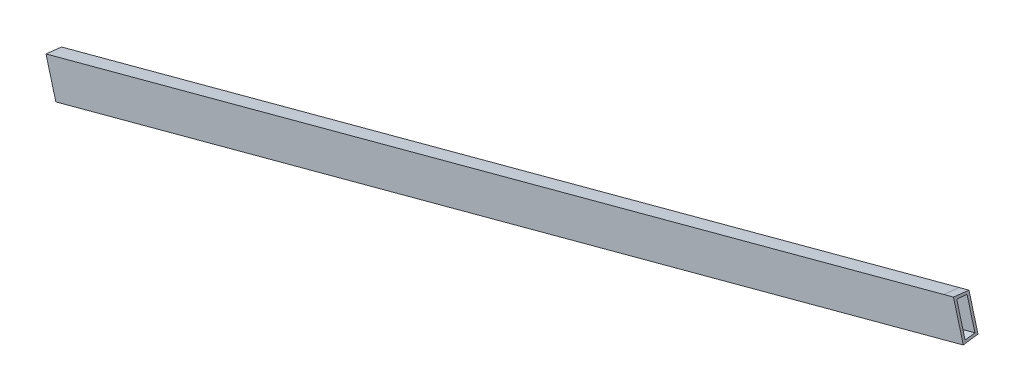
SolidWorks part; units mm, degrees
ref_plane "Front Plane" through (0, 0, 0) normal (0, 0, 1) x (1, 0, 0)
ref_plane "Top Plane" through (0, 0, 0) normal (0, 1, 0) x (1, 0, 0)
ref_plane "Right Plane" through (0, 0, 0) normal (1, 0, 0) x (0, 0, -1)
curve "Curve1"
sketch "Sketch1" plane through (0, 0, 0) normal (1, 0, 0) x (0, 0, -1)
  line L0 (64.2938, 17.9381) -> (64.2938, 7.3735)
  line L1 (0, 0) -> (0, 95.7684) construction
  line L4 (67.4688, 17.6298) -> (67.4688, 7.7502)
  line L5 (65.0938, 17.0589) -> (65.0938, 8.2772)
  line L6 (66.6687, 16.9056) -> (66.6687, 8.4636)
  spline S0 degree 1 poles (65.0938, 8.2772) (66.6687, 8.4636) knots 0 0 1 1 construction
  spline S1 degree 1 poles (66.6687, 16.9056) (65.0938, 17.0589) knots 0 0 1 1 construction
  spline S2 degree 3 poles (65.0938, 8.2772) (65.6186, 8.3406) (66.1436, 8.4027) (66.6687, 8.4636) knots 0.731305 0.731305 0.731305 0.731305 0.736464 0.736464 0.736464 0.736464
  spline S3 degree 3 poles (66.6687, 16.9056) (66.1438, 16.9577) (65.6189, 17.0088) (65.0938, 17.0589) knots 1.268574 1.268574 1.268574 1.268574 1.273764 1.273764 1.273764 1.273764
  spline S5 degree 3 poles (64.2938, 7.3735) (65.3515, 7.504) (66.4098, 7.6297) (67.4688, 7.7502) knots 0.728362 0.728362 0.728362 0.728362 0.738787 0.738787 0.738787 0.738787
  spline S6 degree 3 poles (67.4688, 17.6298) (66.4108, 17.7363) (65.3525, 17.8393) (64.2938, 17.9381) knots 1.266201 1.266201 1.266201 1.266201 1.276646 1.276646 1.276646 1.276646
  dimension "D1" = 0.8001
extrude "Boss-Extrude1" add sketch "Sketch1" along normal blind 25.4
ref_plane "Plane1" through (310.6141, 0, 0) normal (1, 0, 0) x (0, 0, -1)
sketch "Sketch2" plane through (0, 0, -64.2937) normal (0, 0, 1) x (1, 0, 0)
  line L0 (25.4, 7.3735) -> (310.6141, 7.3735) construction
  line L1 (310.6141, -55) -> (310.6141, 55) construction
  line L2 (25.4, 7.3735) -> (310.6141, 83.7963)
  dimension "D1" = 15
sketch "Sketch3" plane through (25.4, 0, 0) normal (1, 0, 0) x (0, 0, -1)
  line L1 (63.5, 18.8093) -> (63.5, 6.4757)
  line L2 (68.2625, 7.0416) -> (68.2625, 18.3477)
  line L6 (64.2938, 17.9381) -> (64.2938, 7.3735)
  line L7 (67.4688, 7.7502) -> (67.4688, 17.6298)
  line L8 (64.2938, 17.9381) -> (64.2938, 7.3735)
  line L9 (67.4688, 7.7502) -> (67.4688, 17.6298)
  spline S0 degree 1 poles (63.5, 6.4757) (68.2625, 7.0416) knots 0 0 1 1 construction
  spline S1 degree 1 poles (68.2625, 18.3477) (63.5, 18.8093) knots 0 0 1 1 construction
  spline S2 degree 3 poles (119.6461, 2956.7409) (-900.6484, -3170.3465) (726.6922, 3146.0713) (392.6353, -2925.1901) knots -1.938074 -1.938074 -1.938074 -1.938074 2.956328 2.956328 2.956328 2.956328 only from (64.2938, 7.3735) to (67.4688, 7.7502)
  spline S3 degree 3 poles (686.639, 2925.5717) (127.9611, -2970.4064) (45.8681, 3002.9346) (-554.569, -2894.7055) knots -0.417714 -0.417714 -0.417714 -0.417714 2.85636 2.85636 2.85636 2.85636 only from (67.4688, 17.6298) to (64.2938, 17.9381)
  spline S4 degree 3 poles (64.2938, 7.3735) (65.3515, 7.504) (66.4098, 7.6297) (67.4688, 7.7502) knots 0.728362 0.728362 0.728362 0.728362 0.738787 0.738787 0.738787 0.738787
  spline S5 degree 3 poles (67.4688, 17.6298) (66.4108, 17.7363) (65.3525, 17.8393) (64.2938, 17.9381) knots 1.266201 1.266201 1.266201 1.266201 1.276646 1.276646 1.276646 1.276646
  spline S6 degree 3 poles (63.5, 6.4757) (65.0866, 6.6716) (66.6741, 6.8609) (68.2625, 7.0416) knots 0.725435 0.725435 0.725435 0.725435 0.741098 0.741098 0.741098 0.741098
  spline S7 degree 3 poles (68.2625, 18.3477) (66.6756, 18.5074) (65.088, 18.6612) (63.5, 18.8093) knots 1.26385 1.26385 1.26385 1.26385 1.279499 1.279499 1.279499 1.279499
  dimension "D1" = 0.7937
  dimension "D2" = 0
sweep "Sweep1" add profiles "Sketch3" path "Sketch2"
sketch "Sketch4" plane through (25.4, 0, 0) normal (-1, 0, 0) x (0, 0, 1)
  line L1 (-79.8649, 22.2221) -> (-55.8678, 22.2221)
  line L2 (-79.8649, 22.2221) -> (-79.8649, 1.8354)
  line L3 (-79.8649, 1.8354) -> (-55.8678, 1.8354)
  line L4 (-55.8678, 22.2221) -> (-55.8678, 1.8354)
extrude "Cut-Extrude1" cut sketch "Sketch4" along normal through all
sketch "Sketch5" plane through (0, 0, -63.5) normal (0, 0, 1) x (1, 0, 0)
  line L0 (25.4, 18.8093) -> (28.4834, 7.3019)
  line L1 (25.4, 6.4757) -> (310.6141, 82.8986) construction
  line L2 (28.4834, 7.3019) -> (25.4, 6.4757)
  line L3 (25.4, 6.4757) -> (25.4, 18.8093)
  line L4 (310.6141, 95.2322) -> (310.6141, 82.8986)
  line L5 (310.6141, 82.8986) -> (307.5307, 94.406)
  line L6 (25.4, 18.8093) -> (310.6141, 95.2322) construction
  line L7 (307.5307, 94.406) -> (310.6141, 95.2322)
  dimension "D1" = 15
  dimension "D2" = 15
extrude "Cut-Extrude2" cut sketch "Sketch5" against normal through all both and the other way through all
sketch "Sketch7" plane through (310.5315, 83.2067, 0) normal (0.9659, 0.2588, 0) x (0, 0, -1)
  line L0 (63.5, 11.5944) -> (63.5, -0.319) construction
  line L1 (63.5, 11.5944) -> (63.5, -0.319)
  line L2 (68.2625, 11.1485) -> (68.2625, 0.2277) construction
  line L3 (68.2625, 11.1485) -> (68.2625, 0.2277)
  line L4 (64.2938, 0.5482) -> (64.2938, 10.7528) construction
  line L5 (64.2938, 0.5482) -> (64.2938, 10.7528)
  line L6 (67.4688, 10.4551) -> (67.4688, 0.9121) construction
  line L7 (67.4688, 10.4551) -> (67.4688, 0.9121)
  spline S0 degree 3 poles (275.4327, -2902.4905) (648.0072, -248.6355) (367.1582, -17.3637) (67.0718, 11.2632) (66.6748, 11.301) (66.2779, 11.3385) (65.8809, 11.3757) (-286.7965, 44.3886) (-665.5105, -198.2892) (-106.4403, 2886.5282) knots -0.90315 -0.90315 -0.90315 -0.90315 0.001196 0.001196 0.001196 0.002392 0.002392 0.002392 1.065051 1.065051 1.065051 1.065051 only from (68.2625, 11.1485) to (63.5, 11.5944) construction
  spline S1 degree 3 poles (68.2625, 11.1485) (67.8656, 11.1871) (67.4687, 11.2253) (67.0718, 11.2632) (66.6748, 11.301) (66.2779, 11.3385) (65.8809, 11.3757) (65.0874, 11.45) (64.2937, 11.5229) (63.5, 11.5944) knots 0 0 0 0 0.001196 0.001196 0.001196 0.002392 0.002392 0.002392 0.004783 0.004783 0.004783 0.004783
  spline S2 degree 3 poles (-707.7686, 2865.0271) (-298.5546, -138.8599) (-122.4642, -22.1015) (64.6907, -0.1782) (65.0877, -0.1317) (65.4847, -0.0856) (65.8818, -0.04) (241.9162, 20.1834) (428.4083, -49.456) (768.0191, -2889.3724) knots -0.564105 -0.564105 -0.564105 -0.564105 0.001199 0.001199 0.001199 0.002398 0.002398 0.002398 0.533976 0.533976 0.533976 0.533976 only from (63.5, -0.319) to (68.2625, 0.2277) construction
  spline S3 degree 3 poles (63.5, -0.319) (63.8969, -0.2716) (64.2938, -0.2247) (64.6907, -0.1782) (65.0877, -0.1317) (65.4847, -0.0856) (65.8818, -0.04) (66.6751, 0.0511) (67.4687, 0.1404) (68.2625, 0.2277) knots 0 0 0 0 0.001199 0.001199 0.001199 0.002398 0.002398 0.002398 0.004794 0.004794 0.004794 0.004794
  spline S4 degree 3 poles (-526.9511, -2906.9877) (-268.07, -51.3938) (-97.237, 25.6175) (65.088, 10.6805) (65.3527, 10.6561) (65.6174, 10.6315) (65.882, 10.6067) (238.8891, -5.628) (402.628, -121.3907) (711.014, 2912.3196) knots -0.488235 -0.488235 -0.488235 -0.488235 0.000797 0.000797 0.000797 0.001595 0.001595 0.001595 0.522897 0.522897 0.522897 0.522897 only from (64.2938, 10.7528) to (67.4688, 10.4551) construction
  spline S5 degree 3 poles (64.2938, 10.7528) (64.5585, 10.729) (64.8232, 10.7049) (65.088, 10.6805) (65.3527, 10.6561) (65.6174, 10.6315) (65.882, 10.6067) (66.411, 10.5571) (66.9399, 10.5065) (67.4688, 10.4551) knots 0 0 0 0 0.000797 0.000797 0.000797 0.001595 0.001595 0.001595 0.003189 0.003189 0.003189 0.003189
  spline S6 degree 3 poles (378.9527, -2932.0884) (549.4948, -177.4338) (295.1273, 26.4754) (66.6743, 0.8238) (66.4095, 0.7941) (66.1448, 0.7641) (65.8801, 0.7337) (-208.9177, -30.7663) (-446.4205, -390.8065) (49.3744, 2946.5665) knots -0.688867 -0.688867 -0.688867 -0.688867 0.000799 0.000799 0.000799 0.001599 0.001599 0.001599 0.831392 0.831392 0.831392 0.831392 only from (67.4688, 0.9121) to (64.2938, 0.5482) construction
  spline S7 degree 3 poles (67.4688, 0.9121) (67.2039, 0.883) (66.9391, 0.8536) (66.6743, 0.8238) (66.4095, 0.7941) (66.1448, 0.7641) (65.8801, 0.7337) (65.3512, 0.6731) (64.8224, 0.6113) (64.2938, 0.5482) knots 0 0 0 0 0.000799 0.000799 0.000799 0.001599 0.001599 0.001599 0.003196 0.003196 0.003196 0.003196
extrude "Boss-Extrude3" add sketch "Sketch7" along normal blind 3.175
